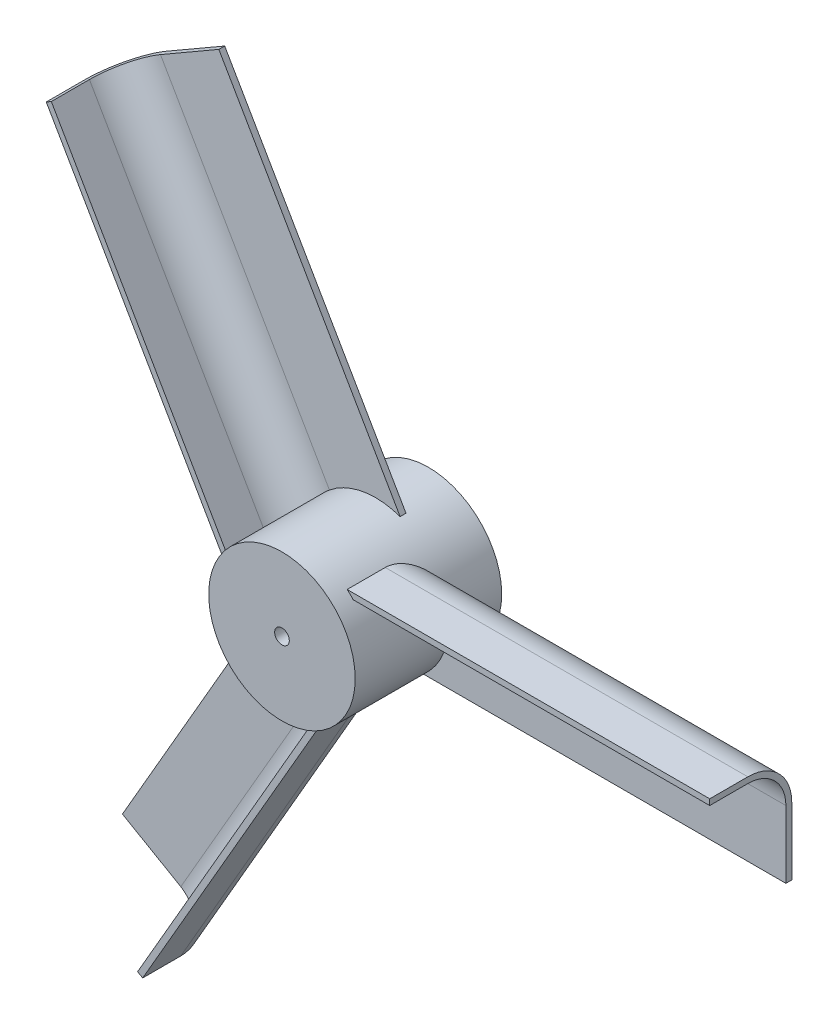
SolidWorks part; units mm, degrees
ref_plane "Front Plane" through (0, 0, 0) normal (0, 0, 1) x (1, 0, 0)
ref_plane "Top Plane" through (0, 0, 0) normal (0, 1, 0) x (1, 0, 0)
ref_plane "Right Plane" through (0, 0, 0) normal (1, 0, 0) x (0, 0, -1)
ref_plane "Plan1" through (70, 0, 0) normal (1, 0, 0) x (0, 0, -1)
sketch "Sketch1" plane through (0, 0, 0) normal (0, 0, 1) x (1, 0, 0)
  circle A0 centre (0, 0) radius 12.5
  circle A1 centre (0, 0) radius 1.25
  dimension "D1" = 2.5
  dimension "D2" = 25
extrude "Boss-Extrude1" add sketch "Sketch1" along normal blind 25
sketch "Sketch3" plane through (70, 0, 0) normal (1, 0, 0) x (0, 0, -1)
  line L2 (-33.9278, 0) -> (21.8313, 0) construction
  line L3 (-25, -12.5) -> (0, -12.5) construction
  line L6 (-8, 2) -> (-8, -9.5)
  line L7 (-8, -9.5) -> (-9, -9.5)
  line L8 (-9, 2) -> (-9, -9.5)
  line L10 (-15.5, 9.5) -> (-22, 9.5)
  line L12 (-15.5, 8.5) -> (-22, 8.5)
  line L13 (-22, 9.5) -> (-22, 8.5)
  line L14 (-25, 12.5) -> (-25, -12.5) construction
  line L15 (0, -12.5) -> (0, 12.5) construction
  arc A2 (-15.5, 8.5) -> (-9, 2) centre (-15.5, 2) cw
  arc A3 (-15.5, 9.5) -> (-8, 2) centre (-15.5, 2) cw
  dimension "D1" = 1
  dimension "D2" = 3
  dimension "D3" = 3
  dimension "D4" = 8
  dimension "D5" = 9.5
  dimension "D6" = 9.5
extrude "Boss-Extrude3" add sketch "Sketch3" against normal up to next
pattern_circular "CirPattern1" count 3 over 360 about axis through (0, 0, 0) along (0, 0, 1) of "Boss-Extrude3"
